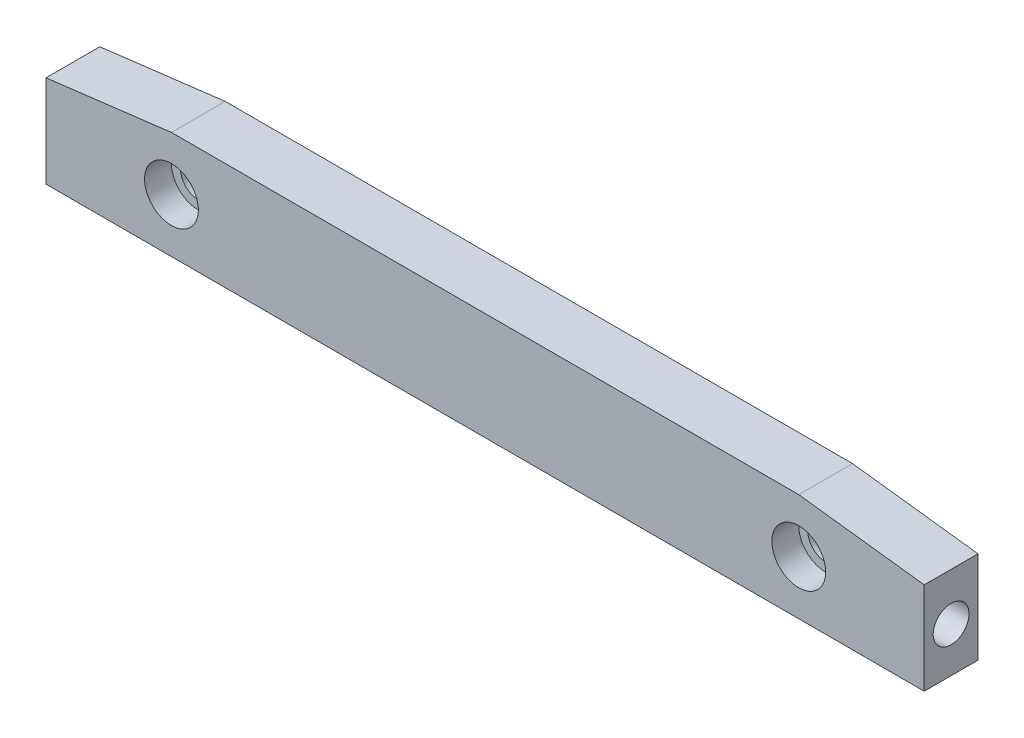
SolidWorks part; units mm, degrees
ref_plane "Front Plane" through (0, 0, 0) normal (0, 0, 1) x (1, 0, 0)
ref_plane "Top Plane" through (0, 0, 0) normal (0, 1, 0) x (1, 0, 0)
ref_plane "Right Plane" through (0, 0, 0) normal (1, 0, 0) x (0, 0, -1)
sketch "Sketch1" plane through (0, 0, 0) normal (0, 0, 1) x (1, 0, 0)
  line L0 (0, 0) -> (77.7875, 0)
  line L1 (77.7875, 0) -> (77.7875, 19.05)
  line L2 (77.7875, 19.05) -> (-77.7875, 19.05)
  line L3 (-77.7875, 19.05) -> (-77.7875, 0)
  line L4 (-77.7875, 0) -> (0, 0)
  line L5 (0, 0) -> (0, 14.3303) construction
  line L6 (-77.7875, 7.9248) -> (-64.6744, 7.9248) construction
  line L7 (77.7875, 7.9248) -> (62.2813, 7.9248) construction
  circle A0 centre (-55.5625, 9.525) radius 3.175
  circle A1 centre (55.5625, 9.525) radius 3.175
  circle A2 centre (55.5625, 9.525) radius 4.7625
  circle A3 centre (-55.5625, 9.525) radius 4.7625
  dimension "D5" = 6.35
  dimension "D6" = 9.525
  dimension "D1" = 19.05
  dimension "D2" = 155.575
  dimension "D3" = 111.125
  dimension "D7" = 9.525
  dimension "D8" = 7.9248
sketch "Sketch2" plane through (0, 0, 0) normal (0, 0, 1) x (1, 0, 0)
  line L0 (-77.7875, 0) -> (0, 0) construction
  line L1 (0, 0) -> (77.7875, 0) construction
  line L2 (77.7875, 0) -> (77.7875, 19.05) construction
  line L3 (77.7875, 19.05) -> (-77.7875, 19.05) construction
  line L4 (-77.7875, 19.05) -> (-77.7875, 0) construction
  line L5 (-77.7875, 0) -> (0, 0)
  line L6 (0, 0) -> (77.7875, 0)
  line L7 (77.7875, 0) -> (77.7875, 19.05)
  line L8 (77.7875, 19.05) -> (-77.7875, 19.05)
  line L9 (-77.7875, 19.05) -> (-77.7875, 0)
  circle A0 centre (-55.5625, 9.525) radius 3.175 construction
  circle A1 centre (55.5625, 9.525) radius 3.175 construction
  circle A2 centre (-55.5625, 9.525) radius 3.175
  circle A3 centre (55.5625, 9.525) radius 3.175
extrude "Boss-Extrude1" add sketch "Sketch2" along normal mid plane 9.525
sketch "Sketch3" plane through (0, 0, 0) normal (0, 0, 1) x (1, 0, 0)
  circle A0 centre (-55.5625, 9.525) radius 4.7625 construction
  circle A1 centre (55.5625, 9.525) radius 4.7625 construction
  circle A2 centre (-55.5625, 9.525) radius 4.7625
  circle A3 centre (55.5625, 9.525) radius 4.7625
extrude "Cut-Extrude1" cut sketch "Sketch3" along normal blind 9.525
hole_wizard "1/4 (0.25) Diameter Hole1" positions "Sketch5" profile "Sketch4" hole size "1/4" standard "ANSI Inch"
sketch "Sketch5" plane through (-77.7875, 0, 0) normal (-1, 0, 0) x (0, 0, 1)
  point P0 (0, 7.9248)
sketch "Sketch4" plane through (-77.7875, 7.9248, 0) normal (0, 1, 0) x (0, 0, 1)
  line L0 (0, 0) -> (0, 17.1477)
  line L1 (0, 17.1477) -> (3.175, 15.24)
  line L2 (3.175, 15.24) -> (3.175, 0)
  line L5 (3.175, 0) -> (0, 0)
  line L10 (0, 17.1477) -> (-3.175, 15.24) construction
  line L11 (0, -6.35) -> (0, 107.95) construction
  dimension "Hole Dia." = 6.35
  dimension "Hole Depth" = 15.24
  dimension "Drill Angle" = 118
hole_wizard "1/4 (0.25) Diameter Hole2" positions "Sketch7" profile "Sketch6" hole size "1/4" standard "ANSI Inch"
sketch "Sketch7" plane through (77.7875, 0, 0) normal (1, 0, 0) x (0, 0, -1)
  point P0 (0, 7.9248)
sketch "Sketch6" plane through (77.7875, 7.9248, 0) normal (0, 1, 0) x (0, 0, -1)
  line L0 (0, 0) -> (0, 17.1477)
  line L1 (0, 17.1477) -> (3.175, 15.24)
  line L2 (3.175, 15.24) -> (3.175, 0)
  line L5 (3.175, 0) -> (0, 0)
  line L10 (0, 17.1477) -> (-3.175, 15.24) construction
  line L11 (0, -6.35) -> (0, 107.95) construction
  dimension "Hole Dia." = 6.35
  dimension "Hole Depth" = 15.24
  dimension "Drill Angle" = 118
chamfer "Chamfer1" distance 22.225 angle 7 1 edges at (-77.7875, 19.05, 0)
chamfer "Chamfer2" distance 22.225 angle 7 1 edges at (77.7875, 19.05, 0)
fillet "Fillet1" [suppressed] radius 3.175
fillet "Fillet2" [suppressed] radius 3.175
